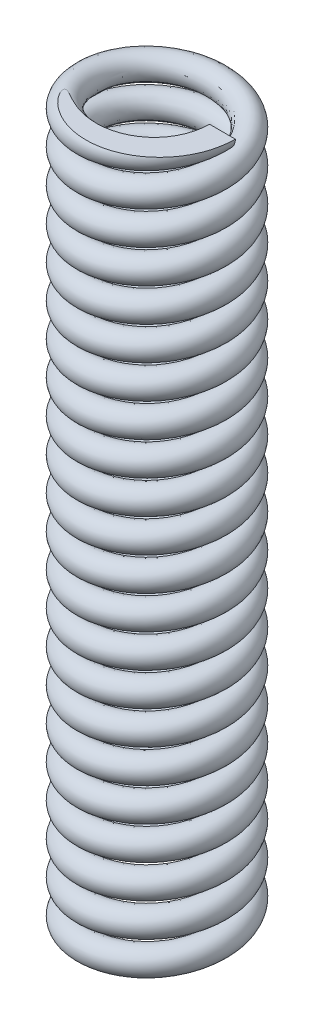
SolidWorks part; units mm, degrees
ref_plane "Front Plane" through (0, 0, 0) normal (0, 0, 1) x (1, 0, 0)
ref_plane "Top Plane" through (0, 0, 0) normal (0, 1, 0) x (1, 0, 0)
ref_plane "Right Plane" through (0, 0, 0) normal (1, 0, 0) x (0, 0, -1)
sketch "Sketch1" plane through (0, 0, 0) normal (0, 0, 1) x (1, 0, 0)
  circle A0 centre (0, 0) radius 0.5715
  dimension "D1" = 1.143
sketch "Sketch5" plane through (0, 0, 0) normal (0, 1, 0) x (1, 0, 0)
  line L0 (-21.0248, -27.3812) -> (18.303, -27.3812) construction
  line L1 (-0.5715, 0) -> (0.5715, 0) construction
  dimension "D1" = 27.3812
sketch "Sketch7" plane through (0, 0, 0) normal (0, 0, 1) x (1, 0, 0)
  line L0 (2.8956, 0) -> (2.8956, 31.6782)
  line L1 (-0.6604, 31.6782) -> (6.4516, 31.6782) construction
  circle A0 centre (0, 0) radius 0.5715 construction
  point P2 (-0.5715, 0)
  dimension "D1" = 3.4671
sweep "Sweep1" add profiles "Sketch1" path "Sketch7" parameters "D1"=7740
sketch "Sketch8" plane through (0, 0, 0) normal (0, 0, 1) x (1, 0, 0)
  line L1 (2.8956, 31.6782) -> (8.6538, 31.6782)
  line L2 (2.8956, 31.6782) -> (2.8956, 33.8243)
  line L3 (2.8956, 33.8243) -> (8.6538, 33.8243)
  line L4 (8.6538, 31.6782) -> (8.6538, 33.8243)
  line L5 (2.8956, 0) -> (-5.2429, 0)
  line L6 (2.8956, 0) -> (2.8956, -3.7161)
  line L7 (2.8956, -3.7161) -> (-5.2429, -3.7161)
  line L8 (-5.2429, 0) -> (-5.2429, -3.7161)
  dimension "D1" = 2.1461
revolve "Cut-Revolve1" cut sketch "Sketch8" angle 360 about L0
sketch "Sketch9" plane through (0, 0, 0) normal (0, 1, 0) x (1, 0, 0)
  circle A0 centre (2.8956, 0) radius 2.53 construction
